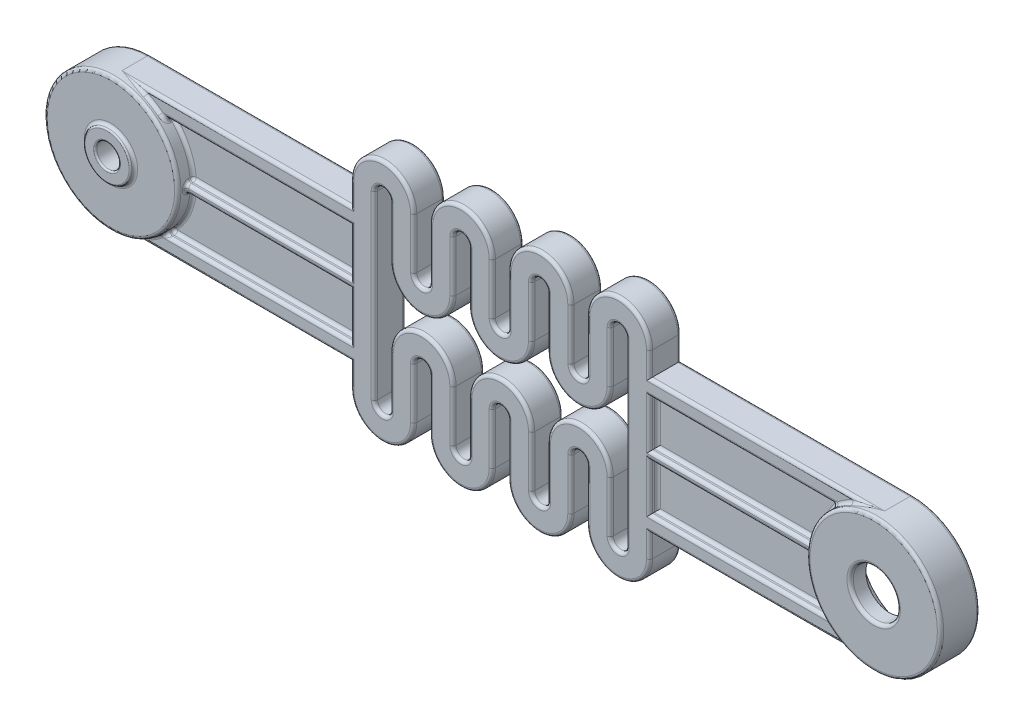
SolidWorks part; units mm, degrees
ref_plane "Face" through (0, 0, 0) normal (0, 0, 1) x (1, 0, 0)
ref_plane "Dessus" through (0, 0, 0) normal (0, 1, 0) x (1, 0, 0)
ref_plane "Droite" through (0, 0, 0) normal (1, 0, 0) x (0, 0, -1)
sketch "Esquisse1" plane through (0, 0, 0) normal (0, 0, 1) x (1, 0, 0)
  line L0 (0, 0) -> (-48.5, 0) construction
  line L1 (-48.5, 8.5) -> (-16, 8.5)
  line L2 (-16, 8.5) -> (-16, -8.5)
  line L3 (-48.5, -8.5) -> (-16, -8.5)
  arc A0 (-48.5, 8.5) -> (-48.5, -8.5) centre (-48.5, 0) ccw
  point P8 (-16, 0)
  dimension "D1" = 17
  dimension "D2" = 32.5
  dimension "D3" = 48.5
extrude "Extrusion1" add sketch "Esquisse1" along normal mid plane 4
sketch "Esquisse2" plane through (0, 0, 0) normal (0, 0, 1) x (1, 0, 0)
  line L0 (-17.5, 8.5) -> (-17.5, 11.5)
  line L1 (-16, 8.5) -> (-48.5, 8.5) construction
  line L2 (-15, 11.5) -> (25.6137, 11.5) construction
  line L3 (-12.5, 11.5) -> (-12.5, 5)
  line L4 (-10, 5) -> (25.6137, 5) construction
  line L5 (-7.5, 5) -> (-7.5, 11.5)
  line L6 (2.5, 5) -> (2.5, 11.5)
  line L7 (-2.5, 11.5) -> (-2.5, 5)
  line L8 (7.5, 11.5) -> (7.5, 5)
  line L9 (12.5, 5) -> (12.5, 11.5)
  line L10 (17.5, 11.5) -> (17.5, 8.5)
  arc A0 (-12.5, 11.5) -> (-17.5, 11.5) centre (-15, 11.5) ccw
  arc A1 (-2.5, 11.5) -> (-7.5, 11.5) centre (-5, 11.5) ccw
  arc A2 (-12.5, 5) -> (-7.5, 5) centre (-10, 5) ccw
  arc A3 (-2.5, 5) -> (2.5, 5) centre (0, 5) ccw
  arc A4 (7.5, 11.5) -> (2.5, 11.5) centre (5, 11.5) ccw
  arc A5 (7.5, 5) -> (12.5, 5) centre (10, 5) ccw
  arc A6 (17.5, 11.5) -> (12.5, 11.5) centre (15, 11.5) ccw
  dimension "D8" = 6.5
  dimension "D2" = 5
  dimension "D3" = 2.5
  dimension "D4" = 5
  dimension "D5" = 17.5
  dimension "D6" = 5
sketch "Esquisse3" plane through (0, 8.5, 0) normal (0, 1, 0) x (-1, 0, 0)
  line L1 (16, -2) -> (19, -2)
  line L2 (16, -2) -> (16, 2)
  line L3 (16, 2) -> (19, 2)
  line L4 (19, -2) -> (19, 2)
  dimension "D1" = 3
sweep "Balayage1" add profiles "Esquisse3" path "Esquisse2"
mirror "Symétrie2" about plane through (0, 0, 0) normal (0, 1, 0)
mirror "Symétrie6" about plane through (0, 0, 0) normal (1, 0, 0)
sketch "Esquisse4" plane through (0, 0, 2) normal (0, 0, 1) x (1, 0, 0)
  circle A0 centre (-48.5, 0) radius 8.5
  circle A1 centre (48.5, 0) radius 8.5
extrude "Extrusion2" add sketch "Esquisse4" along normal blind 1
sketch "Esquisse5" plane through (0, 0, 2) normal (0, 0, 1) x (1, 0, 0)
  line L0 (-43.0228, 6.5) -> (-19, 6.5)
  line L1 (-19, 6.5) -> (-19, 0.5)
  line L2 (-19, 0.5) -> (-40.0147, 0.5)
  line L3 (-19, 11.5) -> (-19, 8.5) construction
  line L4 (-19, 8.5) -> (-48.5, 8.5) construction
  line L5 (-48.5, 0) -> (-11.8269, 0) construction
  line L6 (-19, -0.5) -> (-40.0147, -0.5)
  line L7 (-19, -6.5) -> (-19, -0.5)
  line L8 (-43.0228, -6.5) -> (-19, -6.5)
  line L9 (0, 0) -> (0, 26.4701) construction
  line L10 (43.0228, -6.5) -> (19, -6.5)
  line L11 (19, -6.5) -> (19, -0.5)
  line L12 (19, -0.5) -> (40.0147, -0.5)
  line L13 (19, 0.5) -> (40.0147, 0.5)
  line L14 (19, 6.5) -> (19, 0.5)
  line L15 (43.0228, 6.5) -> (19, 6.5)
  circle A0 centre (-48.5, 0) radius 8.5 construction
  arc A1 (-40.0147, 0.5) -> (-43.0228, 6.5) centre (-48.5, 0) ccw
  arc A2 (-40.0147, -0.5) -> (-43.0228, -6.5) centre (-48.5, 0) cw
  arc A3 (40.0147, -0.5) -> (43.0228, -6.5) centre (48.5, 0) ccw
  arc A4 (40.0147, 0.5) -> (43.0228, 6.5) centre (48.5, 0) cw
  dimension "D1" = 2
  dimension "D2" = 0.5
extrude "Enlèv. mat.-Extru.1" cut sketch "Esquisse5" against normal blind 1
mirror "Symétrie7" about plane through (0, 0, 0) normal (0, 0, 1)
sketch "Esquisse6" plane through (0, 0, 3) normal (0, 0, 1) x (1, 0, 0)
  circle A0 centre (48.5, 0) radius 3
  dimension "D1" = 6
extrude "Enlèv. mat.-Extru.2" cut sketch "Esquisse6" against normal through all
sketch "Esquisse7" plane through (0, 0, -2) normal (0, 0, -1) x (-1, 0, 0)
  circle A0 centre (-48.5, 0) radius 6.5
  dimension "D1" = 13
extrude "Enlèv. mat.-Extru.3" cut sketch "Esquisse7" against normal blind 3
sketch "Esquisse8" plane through (0, 0, 3) normal (0, 0, 1) x (1, 0, 0)
  circle A0 centre (-48.5, 0) radius 3
  dimension "D1" = 6
extrude "Extrusion3" add sketch "Esquisse8" along normal blind 0.5
sketch "Esquisse9" plane through (0, 0, 3.5) normal (0, 0, 1) x (1, 0, 0)
  circle A0 centre (-48.5, 0) radius 1.5
  dimension "D1" = 3
extrude "Enlèv. mat.-Extru.4" cut sketch "Esquisse9" against normal through all
sketch "Esquisse10" plane through (0, 0, -2) normal (0, 0, -1) x (-1, 0, 0)
  circle A0 centre (48.5, 0) radius 6.5
  circle A1 centre (48.5, 0) radius 5
  dimension "D1" = 13
  dimension "D2" = 10
extrude "Enlèv. mat.-Extru.5" cut sketch "Esquisse10" against normal blind 2
fillet "Congé1" radius 0.4
fillet "Congé2" radius 0.2
